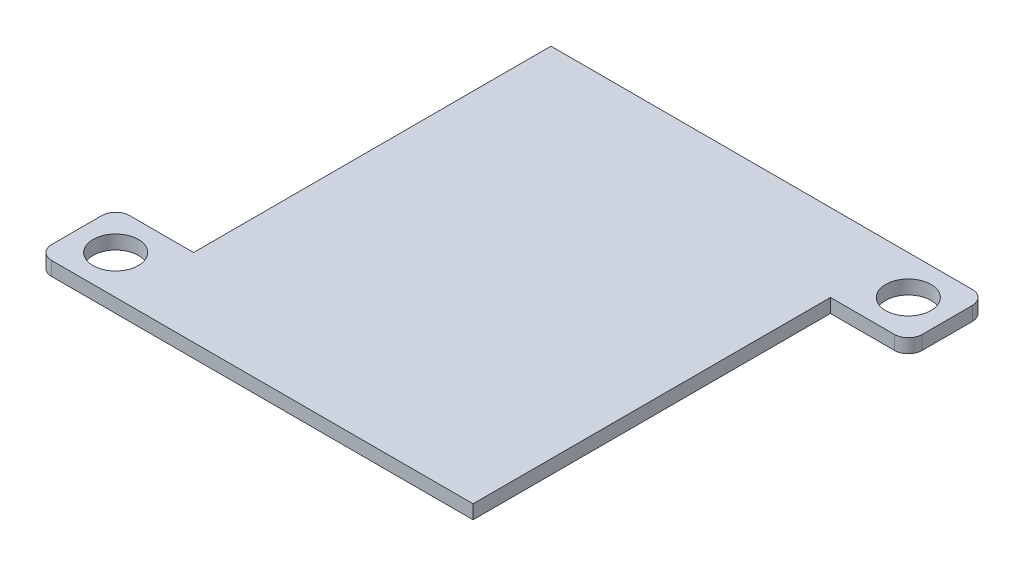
SolidWorks part; units mm, degrees
ref_plane "Front Plane" through (0, 0, 0) normal (0, 0, 1) x (1, 0, 0)
ref_plane "Top Plane" through (0, 0, 0) normal (0, 1, 0) x (1, 0, 0)
ref_plane "Right Plane" through (0, 0, 0) normal (1, 0, 0) x (0, 0, -1)
sketch "Sketch1" plane through (0, 0, 0) normal (0, 1, 0) x (1, 0, 0)
  line L1 (12.9635, -15.7882) -> (-13.2965, -15.7882)
  line L2 (12.9635, -15.7882) -> (12.9635, 9.9118)
  line L3 (12.9635, 15.5118) -> (-12.7365, 15.5118)
  line L4 (-12.7365, -10.1882) -> (-12.7365, 15.5118)
  line L5 (12.9635, -15.7882) -> (-12.7365, 15.5118) construction
  line L7 (12.9635, 15.5118) -> (18.5635, 15.5118)
  line L9 (12.9635, 9.9118) -> (18.5635, 9.9118)
  line L10 (18.5635, 15.5118) -> (18.5635, 9.9118)
  line L11 (-13.2965, -15.7882) -> (-18.3365, -15.7882)
  line L13 (-12.7365, -10.1882) -> (-18.3365, -10.1882)
  line L14 (-18.3365, -15.7882) -> (-18.3365, -10.1882)
  circle A0 centre (15.7635, 12.7118) radius 1.63
  circle A1 centre (-15.5365, -12.9882) radius 1.63
  point P0 (0, 0)
  dimension "D7" = 3.26
  dimension "D8" = 3.26
  dimension "D1" = 31.3
  dimension "D2" = 31.3
  dimension "D3" = 5.6
  dimension "D4" = 5.6
  dimension "D5" = 5.6
  dimension "D6" = 5.6
  dimension "D9" = 31.3
extrude "Boss-Extrude1" add sketch "Sketch1" along normal blind 1
fillet "Fillet1" radius 1 4 edges at (-18.3365, 0.5, 10.1882) (-18.3365, 0.5, 15.7882) (18.5635, 0.5, -15.5118) (18.5635, 0.5, -9.9118)
